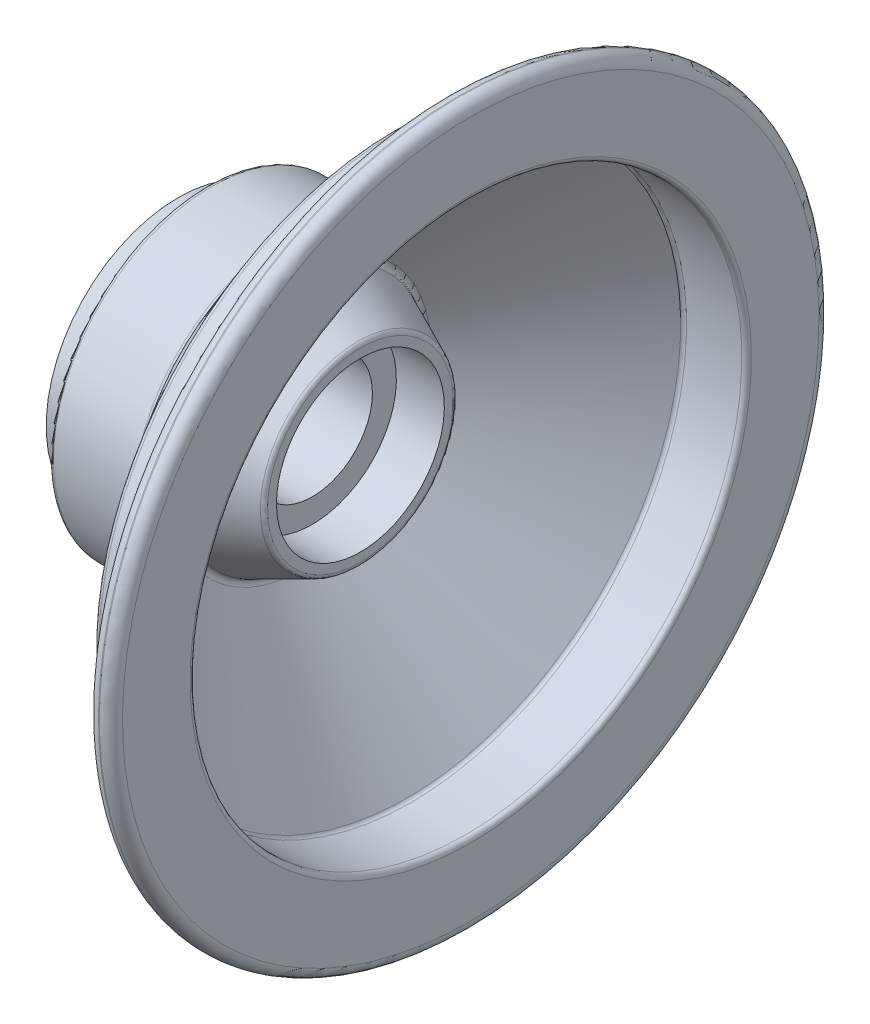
SolidWorks part; units mm, degrees
ref_plane "Face" through (0, 0, 0) normal (0, 0, 1) x (1, 0, 0)
ref_plane "Dessus" through (0, 0, 0) normal (0, 1, 0) x (1, 0, 0)
ref_plane "Droite" through (0, 0, 0) normal (1, 0, 0) x (0, 0, -1)
sketch "Esquisse1" plane through (0, 0, 0) normal (0, 0, 1) x (1, 0, 0)
  line L0 (60.0272, 0) -> (-29.5192, 0) construction
  line L1 (-18, 0) -> (-24, 0) construction
  line L2 (-6, -12.5) -> (-6, -27.5)
  line L3 (-6, -27.5) -> (-6, 27.5) construction
  line L4 (-6, -27.5) -> (0, -27.5)
  line L5 (-6, -12.5) -> (-6, 12.5) construction
  line L6 (-6, -12.5) -> (22, -12.5)
  line L7 (22, -12.5) -> (22, -17.5)
  line L8 (22, -17.5) -> (32, -17.5)
  line L9 (0, -27.5) -> (0, -33)
  line L10 (0, -33) -> (18, -33)
  line L11 (18, -33) -> (39.433, -62.5)
  line L12 (39.433, -62.5) -> (50, -62.5)
  line L13 (50, -62.5) -> (50, -75)
  line L14 (50, -75) -> (55, -75)
  line L15 (55, -75) -> (55, -57.5)
  line L16 (55, -57.5) -> (41.9806, -57.5)
  line L17 (41.9806, -57.5) -> (19, -25.8699)
  line L18 (19, -25.8699) -> (32, -20)
  line L19 (32, -20) -> (32, -17.5)
  dimension "D1" = 66
  dimension "D2" = 25
  dimension "D3" = 55
  dimension "D4" = 50
  dimension "D5" = 5
  dimension "D6" = 150
  dimension "D7" = 115
  dimension "D8" = 125
  dimension "D9" = 37
  dimension "D10" = 54
  dimension "D11" = 23
  dimension "D12" = 10
  dimension "D13" = 35
  dimension "D14" = 5
  dimension "D15" = 40
  dimension "D16" = 25
revolve "Base-Révolution" add sketch "Esquisse1" angle 360 about L0
fillet "Congé1" radius 2.4
fillet "Congé2" radius 1
sketch "Esquisse2" plane through (-6, 0, 0) normal (-1, 0, 0) x (0, 0, 1)
  circle A0 centre (0, 23) radius 2.5
  circle A1 centre (23, 0) radius 2.5
  circle A2 centre (0, -23) radius 2.5
  circle A3 centre (-23, 0) radius 2.5
  dimension "D1" = 5
extrude "Enlèv. mat.-Extru.1" cut sketch "Esquisse2" against normal blind 18
